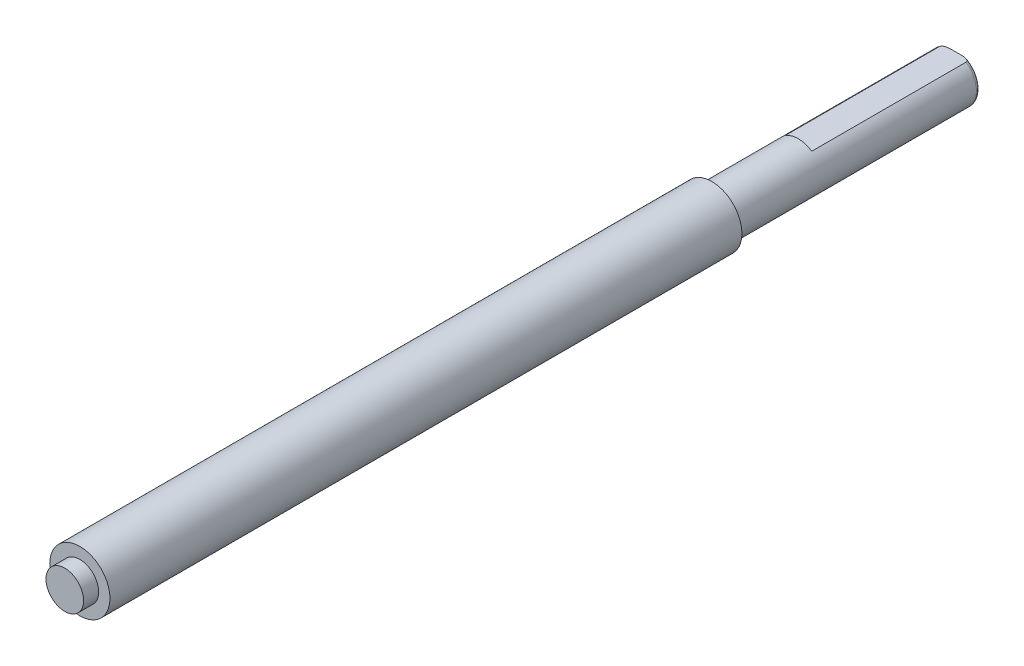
SolidWorks part; units mm, degrees
ref_plane "前视" through (0, 0, 0) normal (0, 0, 1) x (1, 0, 0)
ref_plane "上视" through (0, 0, 0) normal (0, 1, 0) x (1, 0, 0)
ref_plane "右视" through (0, 0, 0) normal (1, 0, 0) x (0, 0, -1)
sketch "草图2" plane through (0, 0, 0) normal (0, 0, 1) x (1, 0, 0)
  circle A0 centre (0, 0) radius 3.175
extrude "凸台-拉伸1" add sketch "草图2" along normal blind 32.5
sketch "草图3" plane through (0, 0, 32.5) normal (0, 0, 1) x (1, 0, 0)
  circle A0 centre (0, 0) radius 4
extrude "凸台-拉伸2" add sketch "草图3" along normal blind 84
sketch "草图4" plane through (0, 0, 0) normal (0, 0, -1) x (-1, 0, 0)
  line L0 (-1.7861, 2.625) -> (1.7861, 2.625)
  arc A0 (1.7861, 2.625) -> (-1.7861, 2.625) centre (0, 0) ccw
extrude "切除-拉伸1" cut sketch "草图4" against normal blind 21
fillet "圆角1" radius 0.5 1 edges at (0, -3.175, 0)
sketch "草图5" plane through (0, 0, 116.5) normal (0, 0, 1) x (1, 0, 0)
  circle A0 centre (0, 0) radius 2.5
extrude "凸台-拉伸3" add sketch "草图5" along normal blind 2
